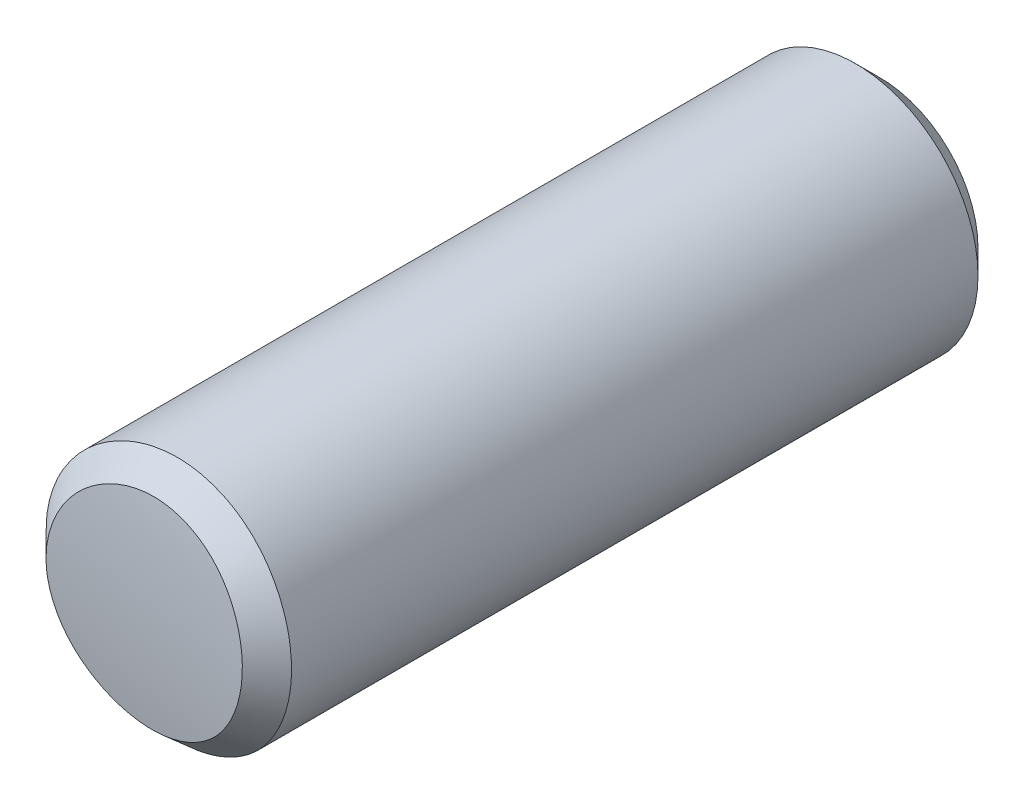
SolidWorks part; units mm, degrees
ref_plane "Plan de face" through (0, 0, 0) normal (0, 0, 1) x (1, 0, 0)
ref_plane "Plan de dessus" through (0, 0, 0) normal (0, 1, 0) x (1, 0, 0)
ref_plane "Plan de droite" through (0, 0, 0) normal (1, 0, 0) x (0, 0, -1)
sketch "Esquisse1" plane through (0, 0, 0) normal (0, 0, 1) x (1, 0, 0)
  circle A0 centre (-166.1426, 57.7203) radius 1.5 construction
  circle A1 centre (-166.1426, 57.7203) radius 1.5
extrude "Extrusion1" add sketch "Esquisse1" along normal up to surface
chamfer "Chanfrein1" distance 0.3 angle 45 2 edges at (-164.6426, 57.7203, 0) (-164.6768, 57.4019, 8.9997)
